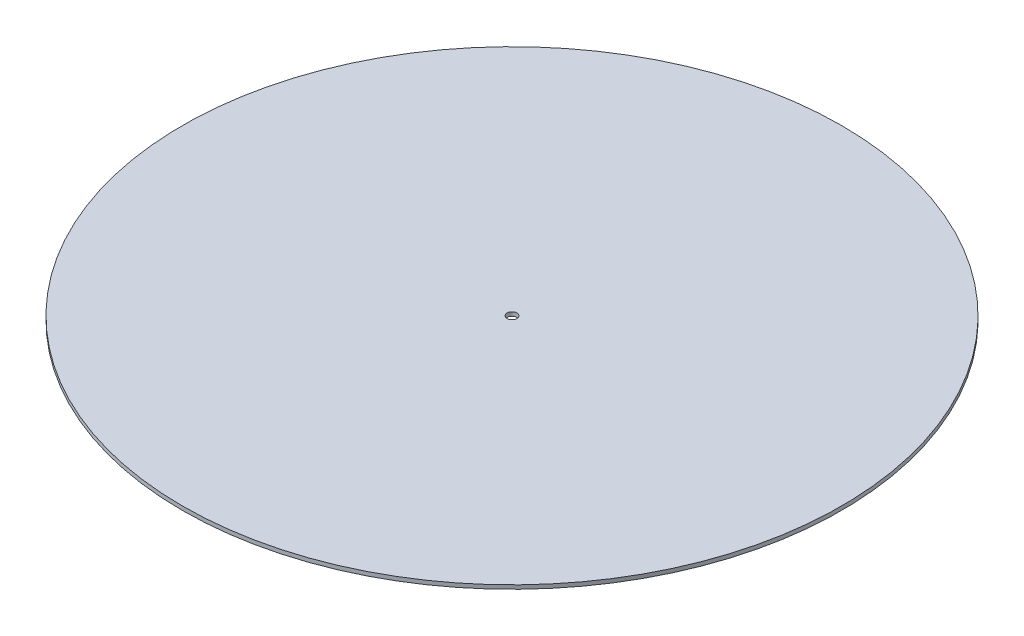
SolidWorks part; units mm, degrees
ref_plane "Front Plane" through (0, 0, 0) normal (0, 0, 1) x (1, 0, 0)
ref_plane "Top Plane" through (0, 0, 0) normal (0, 1, 0) x (1, 0, 0)
ref_plane "Right Plane" through (0, 0, 0) normal (1, 0, 0) x (0, 0, -1)
sketch "Sketch1" plane through (0, 0, 0) normal (0, 1, 0) x (1, 0, 0)
  circle A0 centre (0, 0) radius 134.62
  circle A1 centre (0, 0) radius 2
  dimension "D1" = 4
  dimension "D2" = 269.24
extrude "Boss-Extrude1" add sketch "Sketch1" along normal blind 1.5875
